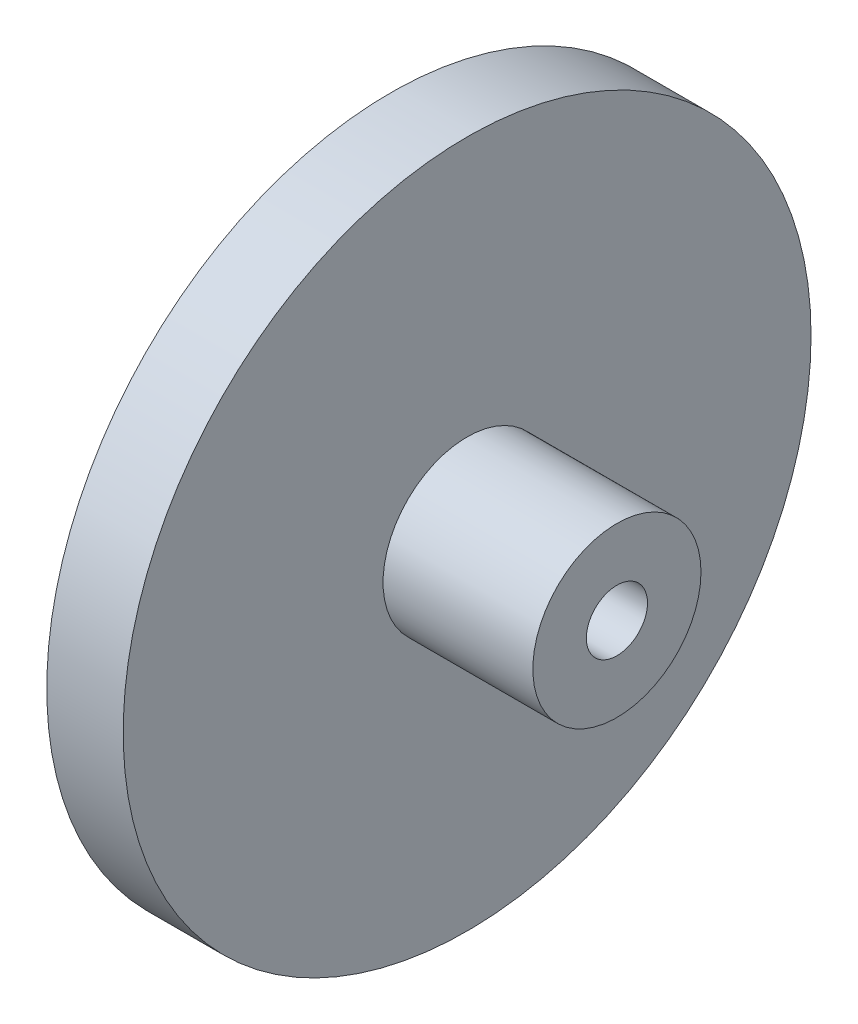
SolidWorks part; units mm, degrees
ref_plane "Plan1" through (0, 0, 0) normal (0, 0, 1) x (1, 0, 0)
ref_plane "Plan2" through (0, 0, 0) normal (0, 1, 0) x (1, 0, 0)
ref_plane "Plan3" through (0, 0, 0) normal (1, 0, 0) x (0, 0, -1)
sketch "Esquisse1" plane through (0, 0, 0) normal (0, 0, 1) x (1, 0, 0)
  line L0 (9.859, 0) -> (-26.0254, 0) construction
  line L1 (0, 0) -> (0, 5.861) construction
  line L2 (-7.4, 11.25) -> (-4.9, 11.25)
  line L3 (-4.9, 11.25) -> (-4.9, 2.75)
  line L4 (0, 1) -> (-7.4, 1)
  line L5 (-7.4, 1) -> (-7.4, 2.9)
  line L6 (-7.4, 2.9) -> (-6.15, 2.9)
  line L7 (-6.15, 2.9) -> (-6.15, 7.75)
  line L8 (-6.15, 7.75) -> (-7.4, 8.75)
  line L9 (-7.4, 8.75) -> (-7.4, 11.25)
  line L10 (-4.9, 2.75) -> (0, 2.75)
  line L11 (0, 2.75) -> (0, 1)
  dimension "D1" = 7.4
  dimension "D2" = 1
  dimension "D3" = 2.9
  dimension "D4" = 1.25
  dimension "D5" = 7.75
  dimension "D6" = 8.75
  dimension "D7" = 1.25
  dimension "D8" = 11.25
  dimension "D9" = 2.5
  dimension "D10" = 2.75
revolve "Base-Révolution" add sketch "Esquisse1" angle 360 about L0
